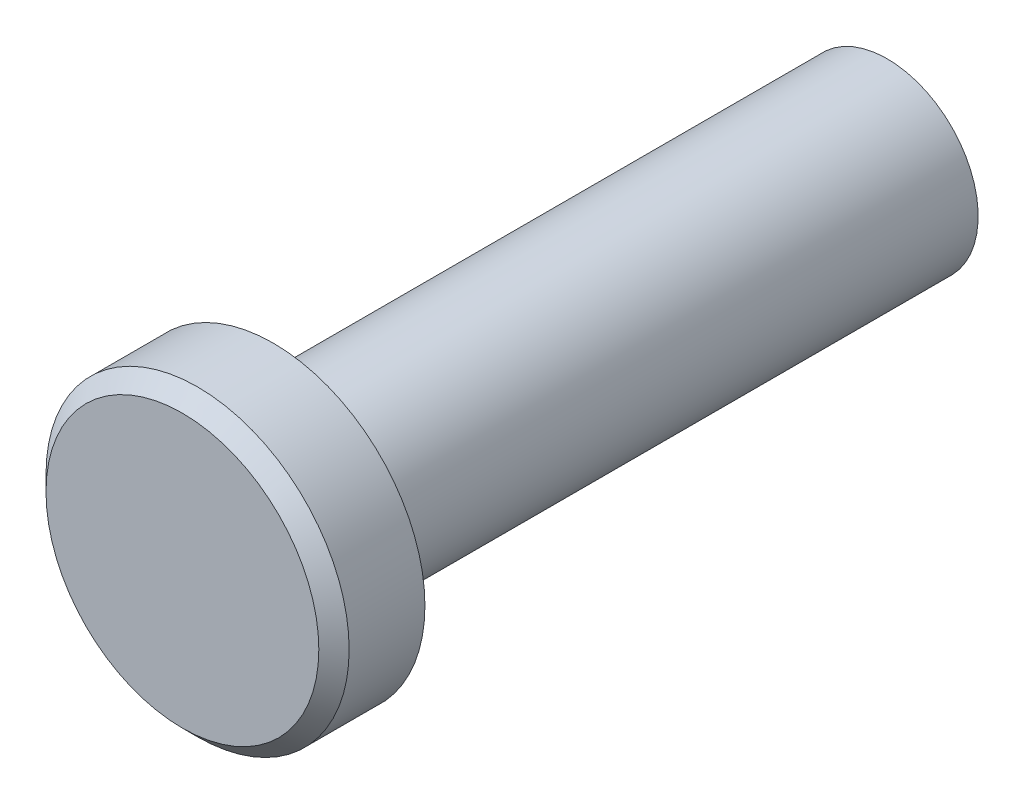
SolidWorks part; units mm, degrees
ref_plane "Front Plane" through (0, 0, 0) normal (0, 0, 1) x (1, 0, 0)
ref_plane "Top Plane" through (0, 0, 0) normal (0, 1, 0) x (1, 0, 0)
ref_plane "Right Plane" through (0, 0, 0) normal (1, 0, 0) x (0, 0, -1)
sketch "Sketch1" plane through (0, 0, 0) normal (0, 0, 1) x (1, 0, 0)
  circle A0 centre (0, 0) radius 5
  dimension "D1" = 10
extrude "Boss-Extrude1" add sketch "Sketch1" along normal blind 3
sketch "Sketch2" plane through (0, 0, 0) normal (0, 0, -1) x (-1, 0, 0)
  circle A0 centre (0, 0) radius 3
  dimension "D1" = 6
extrude "Boss-Extrude2" add sketch "Sketch2" along normal blind 20.25
chamfer "Chamfer1" distance 0.5 angle 45 1 edges at (5, 0, 3)
